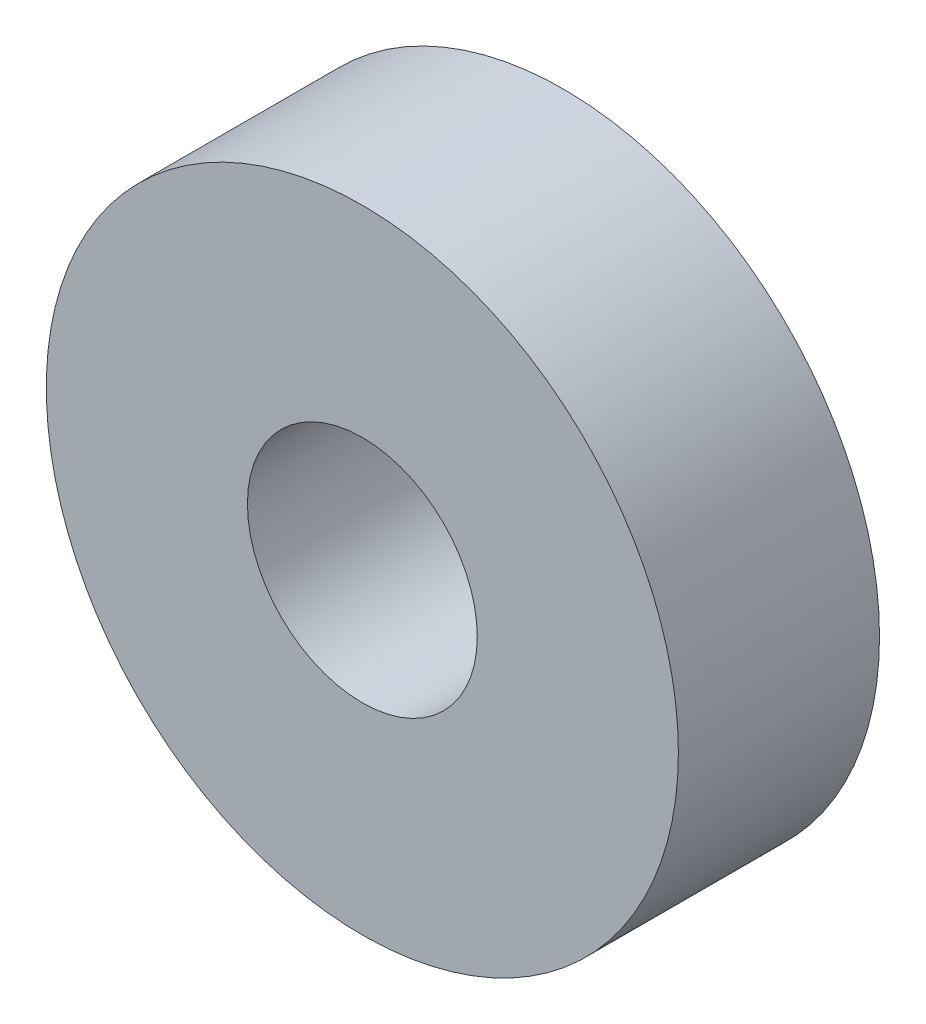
SolidWorks part; units mm, degrees
ref_plane "Ebene vorne" through (0, 0, 0) normal (0, 0, 1) x (1, 0, 0)
ref_plane "Ebene oben" through (0, 0, 0) normal (0, 1, 0) x (1, 0, 0)
ref_plane "Ebene rechts" through (0, 0, 0) normal (1, 0, 0) x (0, 0, -1)
sketch "Skizze1" plane through (0, 0, 0) normal (0, 0, 1) x (1, 0, 0)
  circle A0 centre (0, 0) radius 11
  circle A1 centre (0, 0) radius 4
  dimension "D1" = 22
  dimension "D2" = 8
extrude "Aufsatz-Linear austragen1" add sketch "Skizze1" along normal blind 7
